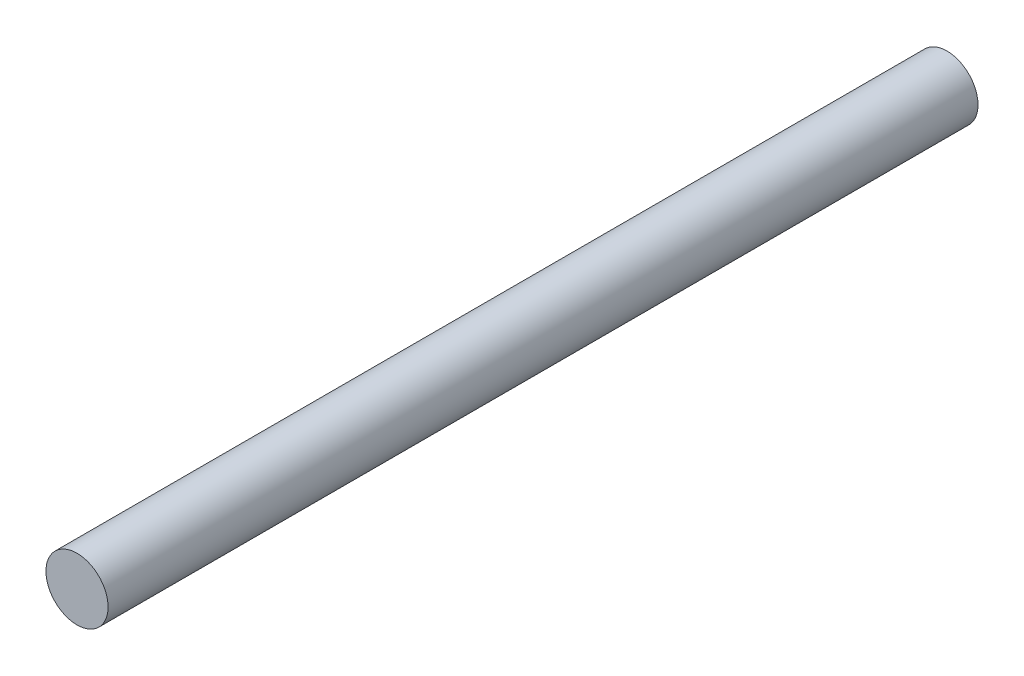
SolidWorks part; units mm, degrees
ref_plane "Front Plane" through (0, 0, 0) normal (0, 0, 1) x (1, 0, 0)
ref_plane "Top Plane" through (0, 0, 0) normal (0, 1, 0) x (1, 0, 0)
ref_plane "Right Plane" through (0, 0, 0) normal (1, 0, 0) x (0, 0, -1)
sketch "Sketch1" plane through (0, 0, 0) normal (0, 0, 1) x (1, 0, 0)
  circle A0 centre (52.7685, 0) radius 3.175
  dimension "D1" = 6.35
extrude "Boss-Extrude1" add sketch "Sketch1" along normal blind 88.9
